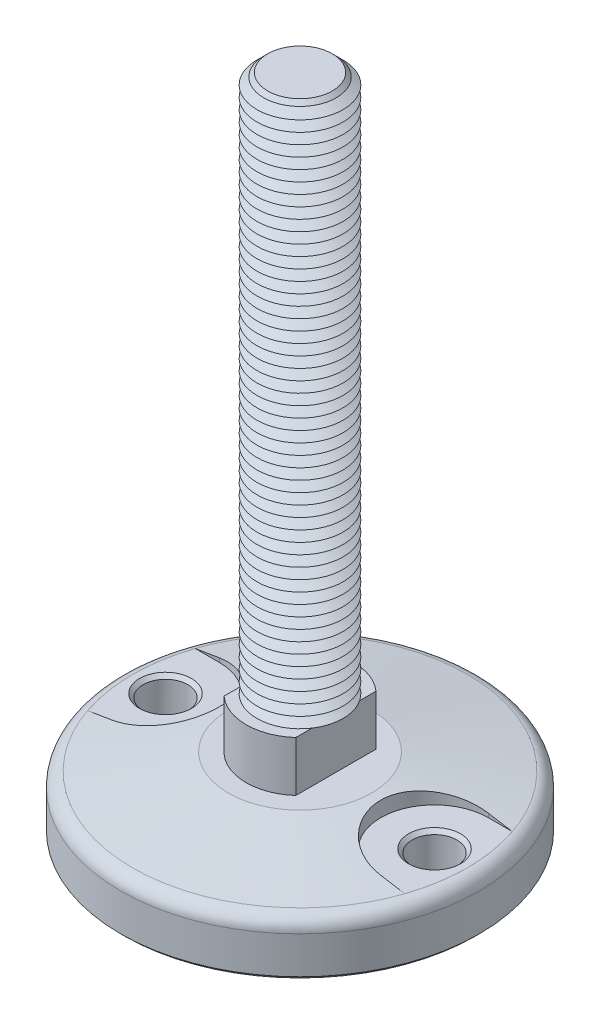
SolidWorks part; units mm, degrees
ref_plane "Front Plane" through (0, 0, 0) normal (0, 0, 1) x (1, 0, 0)
ref_plane "Top Plane" through (0, 0, 0) normal (0, 1, 0) x (1, 0, 0)
ref_plane "Right Plane" through (0, 0, 0) normal (1, 0, 0) x (0, 0, -1)
sketch "Sketch1" plane through (0, 0, 0) normal (1, 0, 0) x (0, 0, -1)
  line L0 (0, 61.3389) -> (0, -58.404) construction
sketch "Sketch2" plane through (0, 0, 0) normal (1, 0, 0) x (0, 0, -1)
  line L0 (0, 0) -> (-20, 0)
  line L1 (-20, 0) -> (-50, -5.2898)
  line L2 (-50, -5.2898) -> (-50, -20)
  line L3 (-50, -20) -> (0, -20)
  line L4 (0, 61.3389) -> (0, -58.404) construction
  line L5 (0, -20) -> (0, 0)
  dimension "D1" = 20
  dimension "D2" = 50
  dimension "D3" = 20
  dimension "D4" = 10
revolve "Revolve1" add sketch "Sketch2" angle 360 about L0
fillet "Fillet1" radius 4 1 edges at (0, -5.2898, 50)
sketch "Sketch3" plane through (0, 0, 0) normal (0, 1, 0) x (1, 0, 0)
  circle A0 centre (0, 0) radius 15
  dimension "D1" = 30
extrude "Boss-Extrude1" add sketch "Sketch3" along normal blind 14
sketch "Sketch4" plane through (0, 14, 0) normal (0, 1, 0) x (1, 0, 0)
  line L0 (-10, 11.1803) -> (-10, -11.1803)
  line L2 (10, -11.1803) -> (10, 11.1803)
  arc A0 (-10, 11.1803) -> (-10, -11.1803) centre (0, 0) ccw
  circle A1 centre (0, 0) radius 15 construction
  arc A2 (10, -11.1803) -> (10, 11.1803) centre (0, 0) ccw
  dimension "D1" = 20
extrude "Cut-Extrude1" cut sketch "Sketch4" against normal blind 14
sketch "Sketch5" plane through (0, 14, 0) normal (0, 1, 0) x (1, 0, 0)
  circle A0 centre (0, 0) radius 12
  dimension "D1" = 24
extrude "Boss-Extrude2" add sketch "Sketch5" along normal blind 150
chamfer "Chamfer1" distance 3 angle 45 1 edges at (0, 164, 12)
sketch "Sketch6" plane through (0, 0, 0) normal (1, 0, 0) x (0, 0, -1)
  line L0 (-12, 14) -> (-9.4019, 15.5)
  line L1 (-9.4019, 15.5) -> (-12, 17)
  line L2 (-12, 161) -> (-12, 14) construction
  line L3 (-12, 17) -> (-12, 14)
  dimension "D1" = 3
revolve "Cut-Revolve1" cut sketch "Sketch6" angle 360 about L0
pattern_linear "LPattern1" count 50 spacing 3 along (0, 1, 0) of "Cut-Revolve1"
sketch "Sketch8" plane through (0, 0, 0) normal (0, 1, 0) x (1, 0, 0)
  line L0 (-37.5, 15) -> (-44.2197, 15)
  line L1 (-37.5, -15) -> (-44.2197, -15)
  arc A1 (-44.2197, 15) -> (-44.2197, -15) centre (0, 0) ccw
  circle A2 centre (0, 0) radius 46.6946 construction
  arc A3 (-37.5, -15) -> (-37.5, 15) centre (-37.5, 0) ccw
  point P3 (-37.5, 0)
  point P11 (0, 0)
  dimension "D1" = 37.5
  dimension "D2" = 30
extrude "Cut-Extrude4" cut sketch "Sketch8" against normal blind 4.7
sketch "Sketch10" plane through (0, -4.7, 0) normal (0, 1, 0) x (1, 0, 0)
  circle A0 centre (-37.5, 0) radius 6.25
  dimension "D1" = 12.5
extrude "Cut-Extrude5" cut sketch "Sketch10" against normal up to surface (15.3 mm away)
chamfer "Chamfer2" distance 1 angle 45 2 edges at (-37.5, -20, -6.25) (-37.5, -4.7, 6.25)
mirror "Mirror1" about plane through (0, 0, 0) normal (1, 0, 0) of "Chamfer2", "Cut-Extrude5", "Cut-Extrude4"
chamfer "Chamfer3" distance 1 angle 45 1 edges at (0, -20, 50)
